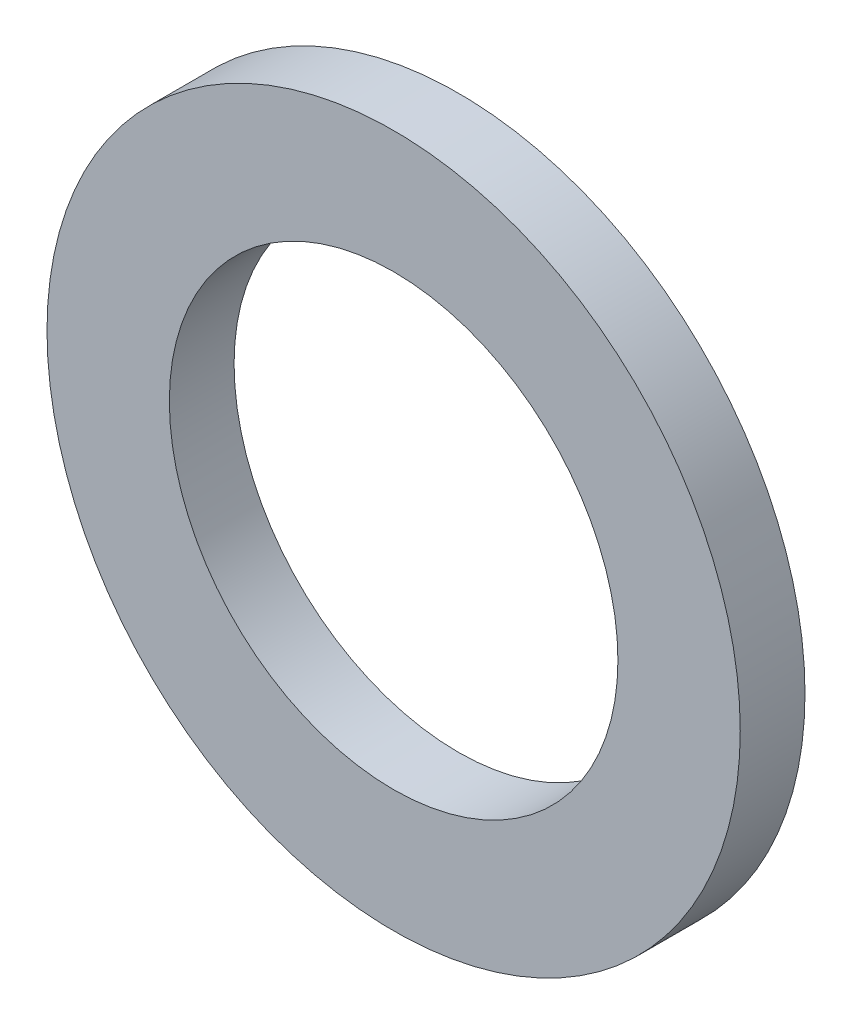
SolidWorks part; units mm, degrees
ref_plane "Front Plane" through (0, 0, 0) normal (0, 0, 1) x (1, 0, 0)
ref_plane "Top Plane" through (0, 0, 0) normal (0, 1, 0) x (1, 0, 0)
ref_plane "Right Plane" through (0, 0, 0) normal (1, 0, 0) x (0, 0, -1)
sketch "Sketch1" plane through (0, 0, 0) normal (0, 0, 1) x (1, 0, 0)
  circle A0 centre (0, 0) radius 11
  circle A1 centre (0, 0) radius 17
  dimension "D1" = 22
  dimension "D2" = 34
extrude "Boss-Extrude1" add sketch "Sketch1" along normal blind 3.175
